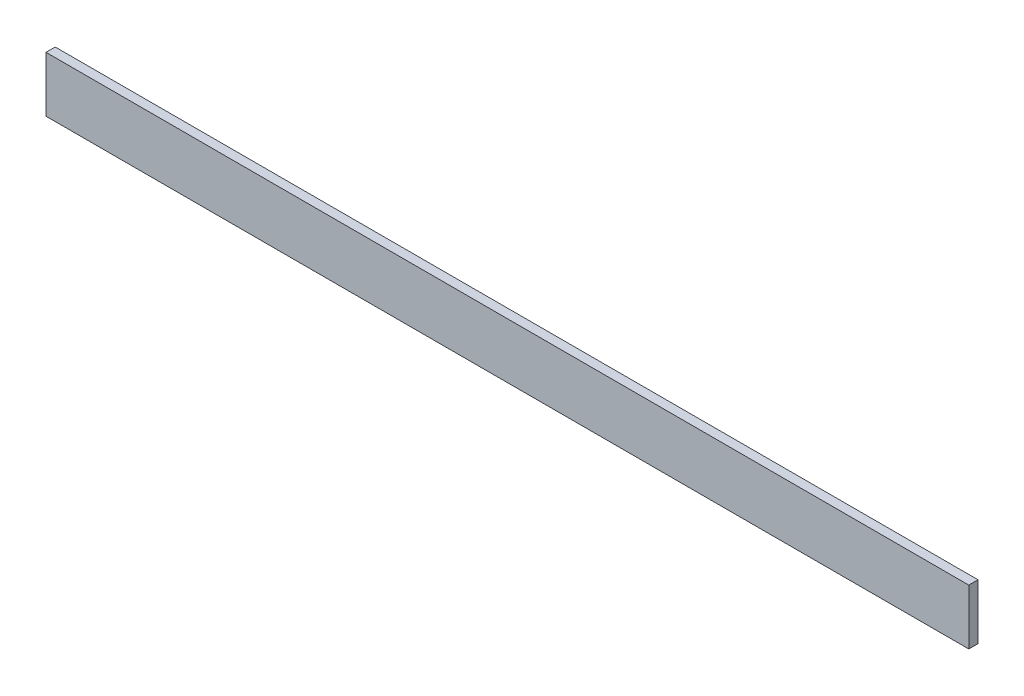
SolidWorks part; units mm, degrees
ref_plane "Plan de face" through (0, 0, 0) normal (0, 0, 1) x (1, 0, 0)
ref_plane "Plan de dessus" through (0, 0, 0) normal (0, 1, 0) x (1, 0, 0)
ref_plane "Plan de droite" through (0, 0, 0) normal (1, 0, 0) x (0, 0, -1)
sketch "Esquisse1" plane through (0, 0, 0) normal (0, 0, 1) x (1, 0, 0)
  line L1 (0, 0) -> (1000, 0)
  line L2 (0, 0) -> (0, 60)
  line L3 (0, 60) -> (1000, 60)
  line L4 (1000, 0) -> (1000, 60)
  dimension "D1" = 1000
  dimension "D2" = 60
extrude "Extrusion1" add sketch "Esquisse1" along normal blind 10
